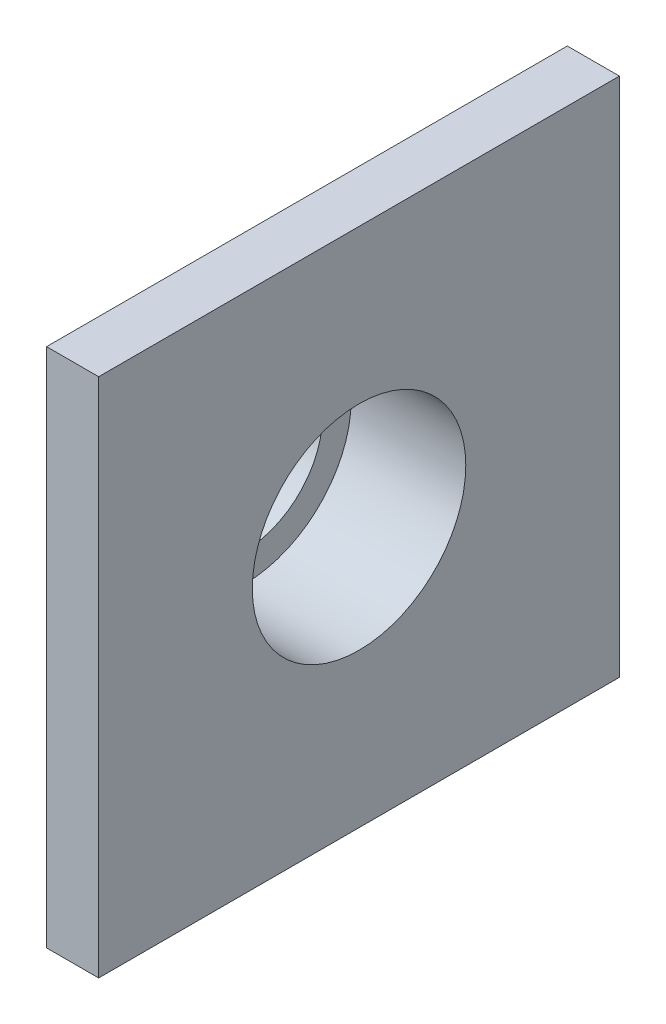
SolidWorks part; units mm, degrees
ref_plane "Front Plane" through (0, 0, 0) normal (0, 0, 1) x (1, 0, 0)
ref_plane "Top Plane" through (0, 0, 0) normal (0, 1, 0) x (1, 0, 0)
ref_plane "Right Plane" through (0, 0, 0) normal (1, 0, 0) x (0, 0, -1)
sketch "Sketch1" plane through (0, 0, 0) normal (1, 0, 0) x (0, 0, -1)
  circle A0 centre (0, 0) radius 1.5
  circle A1 centre (0, 0) radius 2.5
  dimension "D1" = 5
  dimension "D2" = 3
extrude "Boss-Extrude1" add sketch "Sketch1" along normal blind 1
sketch "Sketch2" plane through (1, 0, 0) normal (1, 0, 0) x (0, 0, -1)
  circle A0 centre (0, 0) radius 2.5
  circle A1 centre (0, 0) radius 2.05
  dimension "D1" = 4.1
extrude "Boss-Extrude2" add sketch "Sketch2" along normal blind 1.2
sketch "Sketch3" plane through (2.2, 0, 0) normal (1, 0, 0) x (0, 0, -1)
  line L1 (5, -5) -> (-5, -5)
  line L2 (5, -5) -> (5, 5)
  line L3 (5, 5) -> (-5, 5)
  line L4 (-5, -5) -> (-5, 5)
  line L5 (5, -5) -> (-5, 5) construction
  line L6 (5, 5) -> (-5, -5) construction
  circle A2 centre (0, 0) radius 2.05
  point P0 (0, 0)
  dimension "D1" = 10
  dimension "D2" = 10
extrude "Boss-Extrude3" add sketch "Sketch3" along normal blind 1
